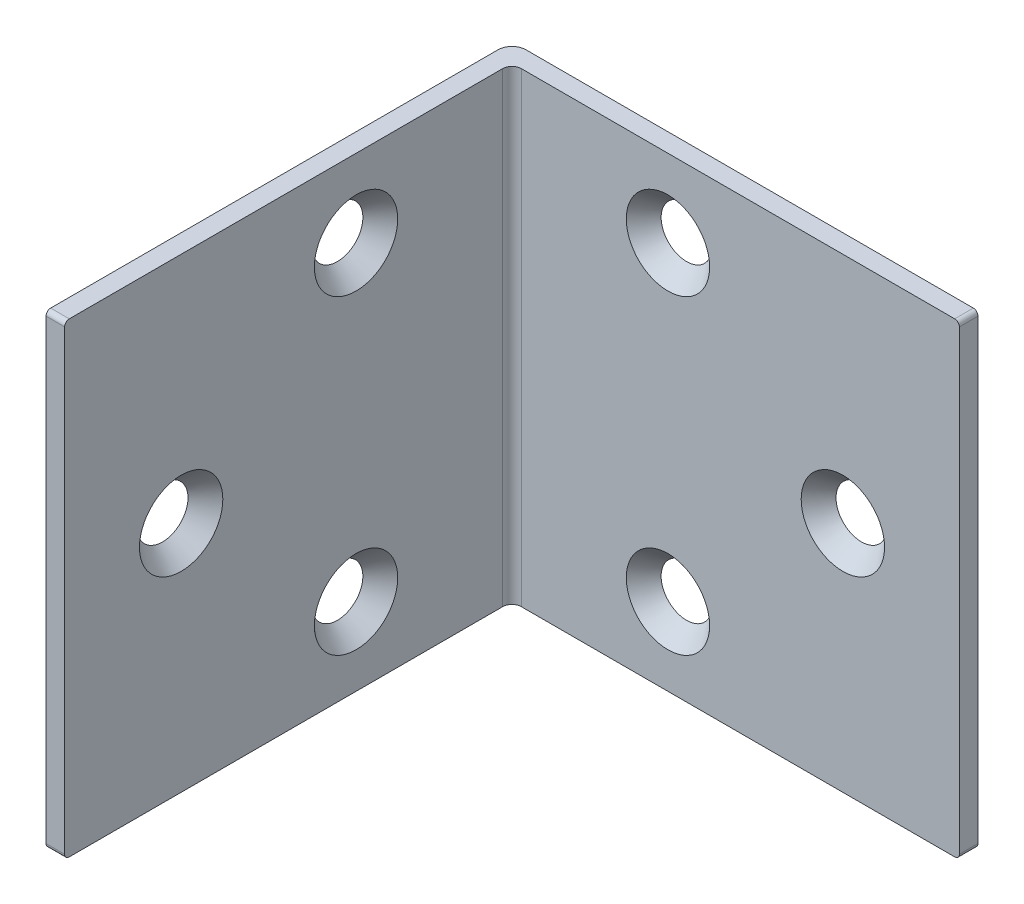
SolidWorks part; units mm, degrees
ref_plane "Front Plane" through (0, 0, 0) normal (0, 0, 1) x (1, 0, 0)
ref_plane "Top Plane" through (0, 0, 0) normal (0, 1, 0) x (1, 0, 0)
ref_plane "Right Plane" through (0, 0, 0) normal (1, 0, 0) x (0, 0, -1)
sketch "Sketch1" plane through (0, 0, 0) normal (0, 1, 0) x (1, 0, 0)
  line L0 (0, 0) -> (0, -37.338) construction
  line L1 (0, 0) -> (37.338, 0) construction
  line L2 (-0.762, -37.338) -> (0.762, -37.338) construction
  line L3 (37.338, -0.762) -> (37.338, 0.762) construction
  line L4 (37.338, 0.762) -> (-0.762, 0.762) construction
  line L5 (-0.762, 0.762) -> (-0.762, -37.338) construction
  line L6 (0.762, -37.338) -> (0.762, -0.762) construction
  line L7 (0.762, -0.762) -> (37.338, -0.762) construction
  point P7 (0, -37.338)
  point P10 (37.338, 0)
sketch "Sketch2" plane through (0, 0, 0) normal (1, 0, 0) x (0, 0, -1)
  line L0 (0, -19.05) -> (0, 19.05) construction
  line L2 (0.762, 0) -> (-37.338, 0) construction
  line L3 (-13.5128, -12.7) -> (-13.5128, 12.7) construction
  line L4 (-15.5956, 12.7) -> (-11.43, 12.7) construction
  point P5 (-27.813, 0)
  point P6 (0, 0)
  point P10 (-13.5128, 0)
  point P13 (-13.5128, 12.7)
sketch "Sketch3" plane through (0, 0, 0) normal (0, 1, 0) x (1, 0, 0)
  line L0 (0.762, -0.762) -> (37.338, -0.762) construction
  line L1 (37.338, -0.762) -> (37.338, 0.762) construction
  line L2 (0.762, -37.338) -> (0.762, -0.762) construction
  line L3 (-0.762, -37.338) -> (0.762, -37.338) construction
  line L4 (-0.762, 0.762) -> (-0.762, -37.338) construction
  line L5 (37.338, 0.762) -> (-0.762, 0.762) construction
  line L6 (0.762, -0.762) -> (37.338, -0.762)
  line L7 (37.338, -0.762) -> (37.338, 0.762)
  line L8 (0.762, -37.338) -> (0.762, -0.762)
  line L9 (-0.762, -37.338) -> (0.762, -37.338)
  line L10 (-0.762, 0.762) -> (-0.762, -37.338)
  line L11 (37.338, 0.762) -> (-0.762, 0.762)
extrude "Boss-Extrude1" add sketch "Sketch3" along normal mid plane 38.1
fillet "Fillet1" radius 1.143 1 edges at (-0.762, 0, -0.762)
fillet "Fillet2" radius 0.762 1 edges at (0.762, 0, 0.762)
fillet "Fillet3" radius 0.381 4 edges at (37.338, -19.05, 0) (37.338, 19.05, 0) (0, -19.05, 37.338) (0, 19.05, 37.338)
sketch "Sketch4" plane through (-0.762, 0, 0) normal (1, 0, 0) x (0, 0, -1)
  line L0 (-15.5956, 12.7) -> (-11.43, 12.7) construction
  circle A0 centre (-27.813, 0) radius 2.0828
  circle A1 centre (-13.5128, 12.7) radius 2.0828
  circle A2 centre (-13.5128, -12.7) radius 2.0828
extrude "Cut-Extrude1" cut sketch "Sketch4" along normal up to next (1.524 mm away) draft 41
sketch "Sketch5" plane through (0, 0, -0.762) normal (0, 0, 1) x (1, 0, 0)
  line L0 (0.762, 0) -> (37.338, 0) construction
  line L2 (37.338, 18.669) -> (37.338, -18.669) construction
  circle A0 centre (13.5128, 12.7) radius 2.0828
  circle A1 centre (13.5128, -12.7) radius 2.0828
  circle A2 centre (27.813, 0) radius 2.0828
extrude "Cut-Extrude2" cut sketch "Sketch5" along normal up to next (1.524 mm away) draft 41
sketch "Sketch6" plane through (0, 0, 0.762) normal (0, 0, 1) x (1, 0, 0)
  line L0 (13.5128, 12.7) -> (13.5128, 16.1076) construction
  line L1 (13.5128, 12.7) -> (15.9223, 15.1095) construction
  circle A0 centre (13.5128, 12.7) radius 3.4076 construction
  point P7 (15.9223, 15.1095)
  point P8 (13.5128, 16.1076)
  dimension "D1" = 45
equation "\"D1@Boss-Extrude1\"=\"Length (C)@Sketch2\""
equation "\"D1@Fillet1\"=\"Thickness@Sketch1\"*.75"
equation "\"D1@Fillet2\"=\"Thickness@Sketch1\"*.5"
equation "\"D1@Fillet3\"=\"Thickness@Sketch1\"*.25"
equation "\"D1@Sketch5\"=\"Hole Diameter@Sketch2\""
equation "\"D2@Sketch5\"=\"Hole Center@Sketch2\""
equation "\"D3@Sketch5\"=\"Horizontal Center to Center@Sketch2\""
